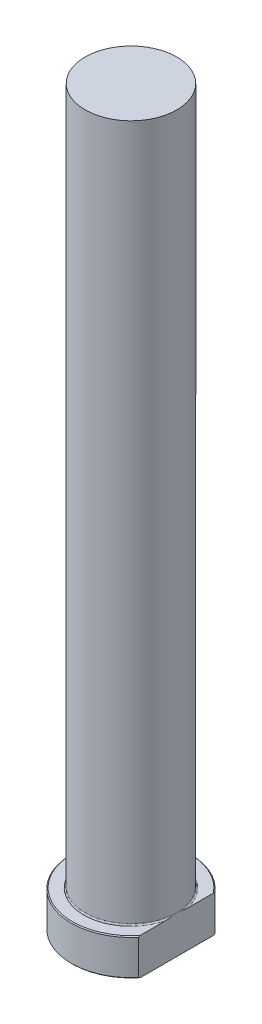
SolidWorks part; units mm, degrees
ref_plane "Front Plane" through (0, 0, 0) normal (0, 0, 1) x (1, 0, 0)
ref_plane "Top Plane" through (0, 0, 0) normal (0, 1, 0) x (1, 0, 0)
ref_plane "Right Plane" through (0, 0, 0) normal (1, 0, 0) x (0, 0, -1)
sketch "Sketch1" plane through (0, 0, 0) normal (0, 0, 1) x (1, 0, 0)
  line L0 (0, 259.9588) -> (0, -15.1925) construction
  line L1 (0, 0) -> (-13, 0)
  line L2 (-13, 0) -> (-13, 8)
  line L3 (-13, 8) -> (-10, 8)
  line L4 (-10, 8) -> (-10, 160)
  line L5 (-10, 160) -> (0, 160)
  line L6 (0, 160) -> (0, 0)
  dimension "L" = 160
  dimension "H" = 26
  dimension "T" = 8
  dimension "D" = 20
revolve "Revolve1" add sketch "Sketch1" angle 360 about L0
chamfer "Chamfer1" distance 0.2 angle 45 2 edges at (0, 8, 13) (0, 0, 13)
fillet "Fillet1" radius 0.3 1 edges at (0, 8, 10)
sketch "Sketch2" plane through (0, 0, 0) normal (0, 1, 0) x (1, 0, 0)
  line L0 (10, 8.3066) -> (10, -8.3066)
  circle A0 centre (0, 0) radius 13 construction
  arc A1 (10, -8.3066) -> (10, 8.3066) centre (0, 0) ccw
  circle A2 centre (0, 0) radius 10 construction
extrude "KEY" cut sketch "Sketch2" along normal through all
